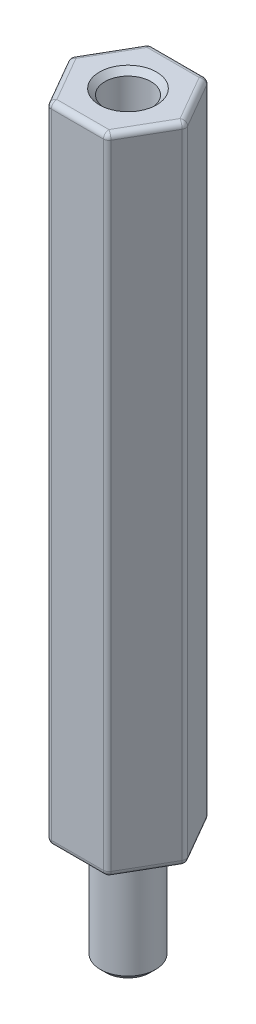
SolidWorks part; units mm, degrees
ref_plane "Front Plane" through (0, 0, 0) normal (0, 0, 1) x (1, 0, 0)
ref_plane "Top Plane" through (0, 0, 0) normal (0, 1, 0) x (1, 0, 0)
ref_plane "Right Plane" through (0, 0, 0) normal (1, 0, 0) x (0, 0, -1)
sketch "Sketch1" plane through (0, 0, 0) normal (0, 1, 0) x (1, 0, 0)
  line L1 (-1.5877, 2.75) -> (-3.1754, 0)
  line L2 (-3.1754, 0) -> (-1.5877, -2.75)
  line L3 (-1.5877, -2.75) -> (1.5877, -2.75)
  line L4 (1.5877, -2.75) -> (3.1754, 0)
  line L5 (3.1754, 0) -> (1.5877, 2.75)
  line L6 (1.5877, 2.75) -> (-1.5877, 2.75)
  circle A0 centre (0, 0) radius 2.75 construction
  circle A1 centre (0, 0) radius 1.25
  dimension "D2" = 2.5
  dimension "D1" = 5.5
extrude "Boss-Extrude1" add sketch "Sketch1" along normal blind 35
fillet "Fillet1" radius 0.3 6 edges at (1.5877, 17.5, -2.75) (3.1754, 17.5, 0) (-1.5877, 17.5, -2.75) (-3.1754, 17.5, 0) (-1.5877, 17.5, 2.75) (1.5877, 17.5, 2.75)
fillet "Fillet2" radius 0.3 24 edges at (-1.5645, 0, 2.7098) (-2.3816, 0, 1.375) (-3.129, 0, 0) (-2.3816, 0, -1.375) (-1.5645, 0, -2.7098) (0, 0, -2.75) (1.5645, 0, -2.7098) (2.3816, 0, -1.375) (3.129, 0, 0) (2.3816, 0, 1.375) (1.5645, 0, 2.7098) (-1.5645, 35, 2.7098) (-2.3816, 35, 1.375) (-3.129, 35, 0) (-2.3816, 35, -1.375) (-1.5645, 35, -2.7098) (0, 35, -2.75) (1.5645, 35, -2.7098) (2.3816, 35, -1.375) (3.129, 35, 0) (2.3816, 35, 1.375) (1.5645, 35, 2.7098) (0, 0, 2.75) (0, 35, 2.75)
sketch "Sketch2" plane through (0, 0, 0) normal (0, -1, 0) x (1, 0, 0)
  circle A0 centre (0, 0) radius 1.5
  dimension "D1" = 3
extrude "Boss-Extrude2" add sketch "Sketch2" along normal blind 6
chamfer "Chamfer1" distance 0.3 angle 45 2 edges at (0, 35, 1.25) (0, -6, -1.5)
fillet "Fillet3" radius 0.3 1 edges at (0, 0, 1.5)
